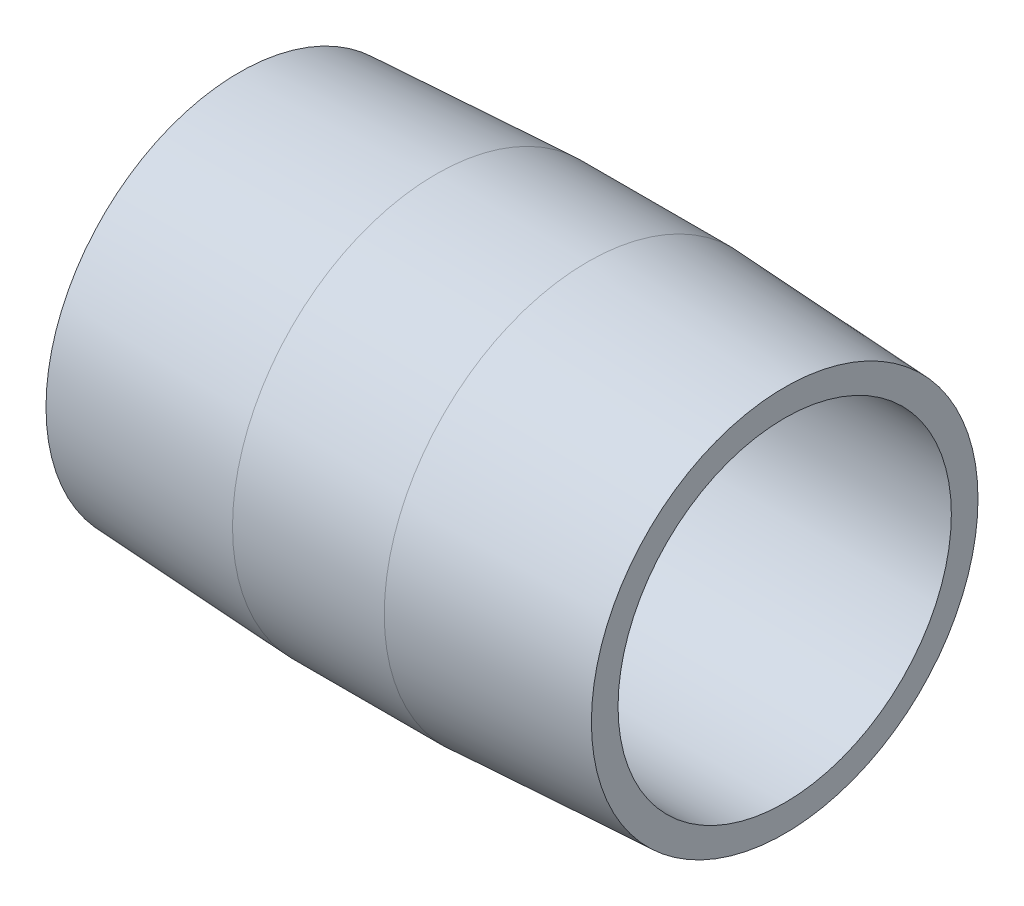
SolidWorks part; units mm, degrees
ref_plane "Front Plane" through (0, 0, 0) normal (0, 0, 1) x (1, 0, 0)
ref_plane "Top Plane" through (0, 0, 0) normal (0, 1, 0) x (1, 0, 0)
ref_plane "Right Plane" through (0, 0, 0) normal (1, 0, 0) x (0, 0, -1)
sketch "Sketch1" plane through (0, 0, 0) normal (0, 0, 1) x (1, 0, 0)
  line L6 (28.575, 8.7312) -> (0, 8.7313)
  line L7 (10.3124, 10.668) -> (0, 10.1276)
  line L8 (18.2626, 10.668) -> (10.3124, 10.668)
  line L9 (28.575, 10.1276) -> (18.2626, 10.668)
  line L10 (28.575, 8.7312) -> (28.575, 10.1276)
  line L11 (0, 10.1276) -> (0, 8.7313)
  line L12 (0, 0) -> (50000, 0) construction
  line L13 (0, -55) -> (0, 55) construction
  dimension "D1" = 28.575
  dimension "D2" = 3
  dimension "D3" = 3
  dimension "D4" = 21.336
  dimension "D5" = 17.4625
  dimension "D6" = 10.3124
  dimension "D7" = 10.3124
revolve "Revolve1" add sketch "Sketch1" angle 360 about L12
